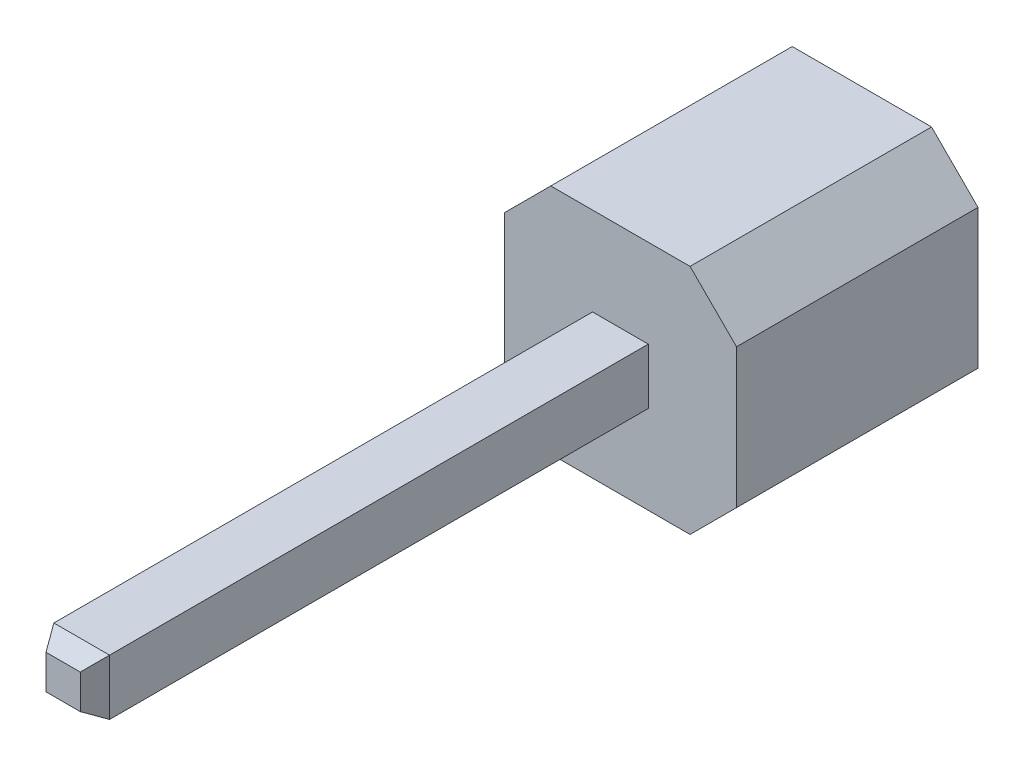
SolidWorks part; units mm, degrees
ref_plane "前视基准面" through (0, 0, 0) normal (0, 0, 1) x (1, 0, 0)
ref_plane "上视基准面" through (0, 0, 0) normal (0, 1, 0) x (1, 0, 0)
ref_plane "右视基准面" through (0, 0, 0) normal (1, 0, 0) x (0, 0, -1)
sketch "草图1" plane through (0, 0, 0) normal (0, 0, 1) x (1, 0, 0)
  line L0 (-1.25, 0.75) -> (-0.75, 1.25)
  line L1 (-0.75, 1.25) -> (0.75, 1.25)
  line L2 (-1.25, 0.75) -> (-1.25, -0.75)
  line L3 (-0.75, -1.25) -> (0.75, -1.25)
  line L4 (1.25, 0.75) -> (1.25, -0.75)
  line L5 (-1.25, 1.25) -> (1.25, -1.25) construction
  line L6 (-1.25, -1.25) -> (1.25, 1.25) construction
  line L7 (0.75, -1.25) -> (1.25, -0.75)
  line L8 (-1.25, -0.75) -> (-0.75, -1.25)
  line L9 (0.75, 1.25) -> (1.25, 0.75)
  point P0 (0, 0)
  dimension "D1" = 2.5
  dimension "D2" = 2.5
extrude "凸台-拉伸1" add sketch "草图1" along normal blind 2.6
sketch "草图2" plane through (0, 0, 2.6) normal (0, 0, 1) x (1, 0, 0)
  line L1 (-0.3, 0.3) -> (0.3, 0.3)
  line L2 (-0.3, 0.3) -> (-0.3, -0.3)
  line L3 (-0.3, -0.3) -> (0.3, -0.3)
  line L4 (0.3, 0.3) -> (0.3, -0.3)
  line L5 (-0.3, 0.3) -> (0.3, -0.3) construction
  line L6 (-0.3, -0.3) -> (0.3, 0.3) construction
  point P0 (0, 0)
  dimension "D1" = 0.6
  dimension "D2" = 0.6
extrude "凸台-拉伸2" add sketch "草图2" along normal blind 6
chamfer "倒角1" distance 0.2 angle 30 4 edges at (0, 0.3, 8.6) (-0.3, 0, 8.6) (0.3, 0, 8.6) (0, -0.3, 8.6)
